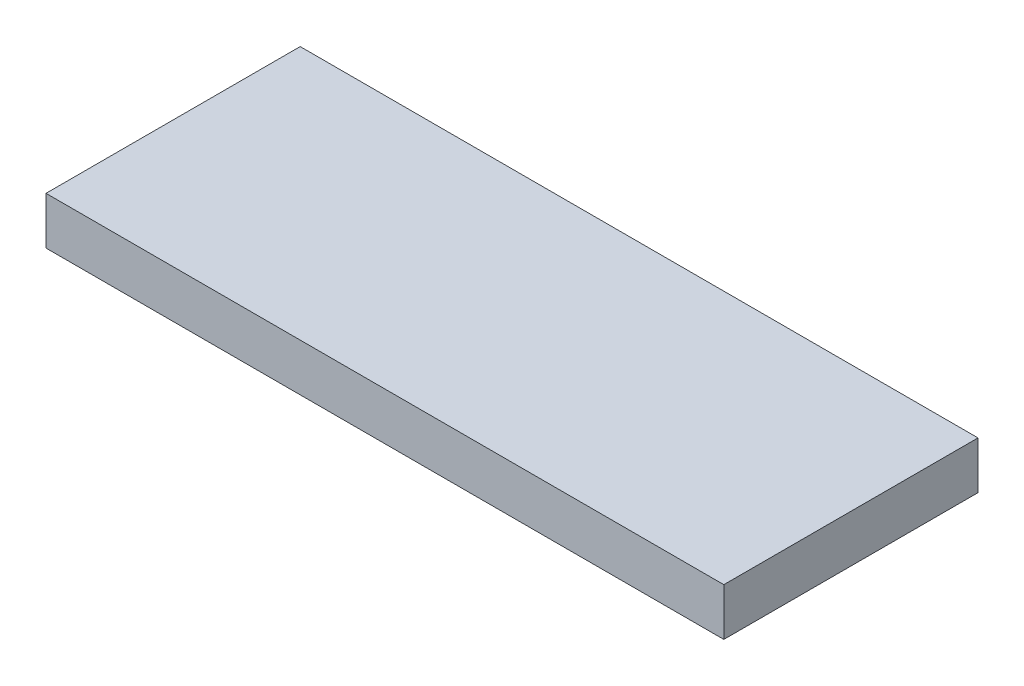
SolidWorks part; units mm, degrees
ref_plane "Front Plane" through (0, 0, 0) normal (0, 0, 1) x (1, 0, 0)
ref_plane "Top Plane" through (0, 0, 0) normal (0, 1, 0) x (1, 0, 0)
ref_plane "Right Plane" through (0, 0, 0) normal (1, 0, 0) x (0, 0, -1)
sketch "Sketch1" plane through (0, 0, 0) normal (0, 1, 0) x (1, 0, 0)
  line L1 (0, 0) -> (40, 0)
  line L2 (0, 0) -> (0, 15)
  line L3 (0, 15) -> (40, 15)
  line L4 (40, 0) -> (40, 15)
extrude "Boss-Extrude1" add sketch "Sketch1" along normal blind 2.8
